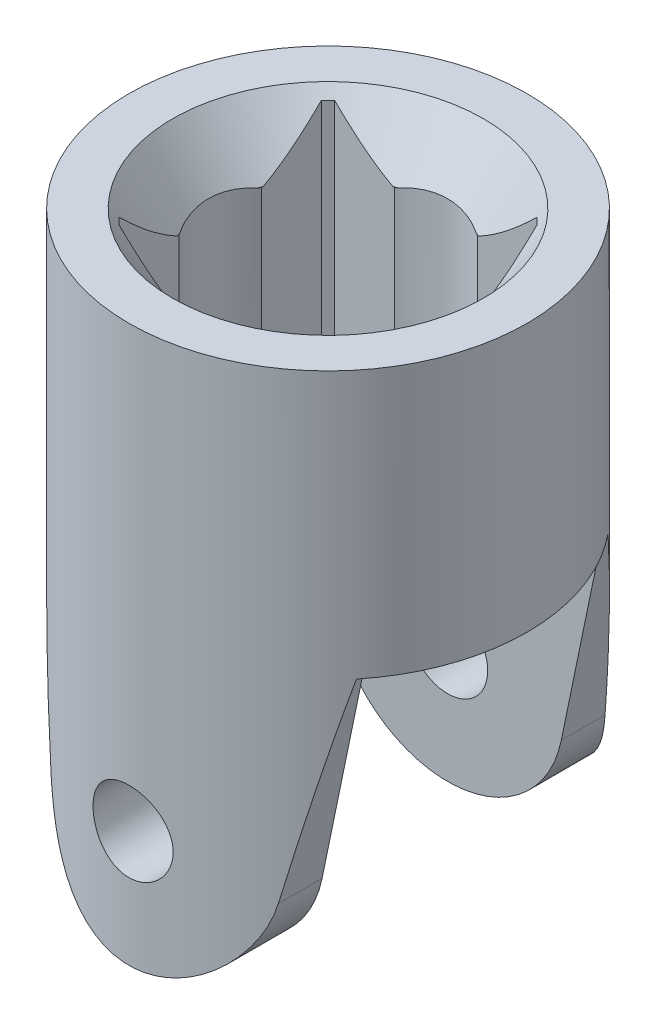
SolidWorks part; units mm, degrees
ref_plane "Front Plane" through (0, 0, 0) normal (0, 0, 1) x (1, 0, 0)
ref_plane "Top Plane" through (0, 0, 0) normal (0, 1, 0) x (1, 0, 0)
ref_plane "Right Plane" through (0, 0, 0) normal (1, 0, 0) x (0, 0, -1)
sketch "Sketch1" plane through (0, 0, 0) normal (0, 1, 0) x (1, 0, 0)
  circle A0 centre (0, 0) radius 12
  dimension "D1" = 24
extrude "Boss-Extrude1" add sketch "Sketch1" along normal blind 33.53
sketch "Sketch2" plane through (0, 33.53, 0) normal (0, 1, 0) x (1, 0, 0)
  line L0 (-6.5, 6.5) -> (-2.5, 6.5)
  line L1 (-6.5, 6.5) -> (6.5, 6.5) construction
  line L2 (-6.5, 6.5) -> (-6.5, -6.5) construction
  line L3 (-6.5, -6.5) -> (6.5, -6.5) construction
  line L4 (6.5, 6.5) -> (6.5, -6.5) construction
  line L5 (-6.5, 6.5) -> (6.5, -6.5) construction
  line L6 (-6.5, -6.5) -> (6.5, 6.5) construction
  line L7 (2.5, 6.5) -> (6.5, 6.5)
  line L8 (6.5, 6.5) -> (6.5, 2.5)
  line L9 (6.5, -2.5) -> (6.5, -6.5)
  line L10 (6.5, -6.5) -> (2.5, -6.5)
  line L11 (-2.5, -6.5) -> (-6.5, -6.5)
  line L12 (-6.5, -6.5) -> (-6.5, -2.5)
  line L13 (-6.5, 2.5) -> (-6.5, 6.5)
  arc A0 (-2.5, 6.5) -> (2.5, 6.5) centre (0, 2.4611) cw
  arc A1 (6.5, 2.5) -> (6.5, -2.5) centre (2.4611, 0) cw
  arc A2 (2.5, -6.5) -> (-2.5, -6.5) centre (0, -2.4611) cw
  arc A3 (-6.5, -2.5) -> (-6.5, 2.5) centre (-2.4611, 0) cw
  point P0 (0, 0)
  point P9 (0, 7.2111)
  point P28 (0, 0)
  dimension "D3" = 4.75
  dimension "D1" = 13
  dimension "D2" = 4
  dimension "D4" = 4
extrude "Cut-Extrude1" cut sketch "Sketch2" against normal blind 19.6
chamfer "Chamfer1" distance 0.4 angle 45 4 edges at (-6.5, 23.73, 6.5) (6.5, 23.73, 6.5) (-6.5, 23.73, -6.5) (6.5, 23.73, -6.5)
sketch "Sketch3" plane through (0, 33.53, 0) normal (0, 1, 0) x (1, 0, 0)
  circle A0 centre (0, 0) radius 9.375
  dimension "D1" = 18.75
extrude "Cut-Extrude2" cut sketch "Sketch3" against normal blind 3.4 draft 35
sketch "Sketch4" plane through (0, 0, 0) normal (0, -1, 0) x (1, 0, 0)
  line L1 (-12, 7.2111) -> (12, 7.2111)
  line L2 (-12, 7.2111) -> (-12, -7.2111)
  line L3 (-12, -7.2111) -> (12, -7.2111)
  line L4 (12, 7.2111) -> (12, -7.2111)
  arc A0 (2.5, 6.5) -> (-2.5, 6.5) centre (0, 2.4611) ccw construction
  arc A1 (-2.5, -6.5) -> (2.5, -6.5) centre (0, -2.4611) ccw construction
  circle A2 centre (0, 0) radius 12 construction
extrude "Cut-Extrude3" cut sketch "Sketch4" against normal blind 17.4
sketch "Sketch5" plane through (0, 0, 0) normal (0, 0, 1) x (1, 0, 0)
  line L0 (12, 17.4) -> (9.3, 17.4)
  line L1 (9.3, 17.4) -> (6.8548, 5.5817)
  line L2 (0, 0) -> (0, 33.53) construction
  line L3 (12, 33.53) -> (-12, 33.53) construction
  line L4 (-12, 17.4) -> (-9.3, 17.4)
  line L5 (-9.3, 17.4) -> (-6.8548, 5.5817)
  line L6 (-6.8548, 5.5817) -> (6.8548, 5.5817) construction
  line L7 (-12, 17.4) -> (-12, -3.1923)
  line L8 (-12, -3.1923) -> (12, -3.1923)
  line L9 (12, -3.1923) -> (12, 17.4)
  arc A0 (-6.8548, 5.5817) -> (6.8548, 5.5817) centre (0, 7) ccw
  circle A1 centre (0, 7) radius 2.415
  point P18 (0, 0)
  dimension "D1" = 7
  dimension "D3" = 4.83
  dimension "D2" = 2.7
extrude "Cut-Extrude4" cut sketch "Sketch5" against normal mid plane 67.4 contours A1 | A0 L5 L4 L7 L8 L9 L0 L1
